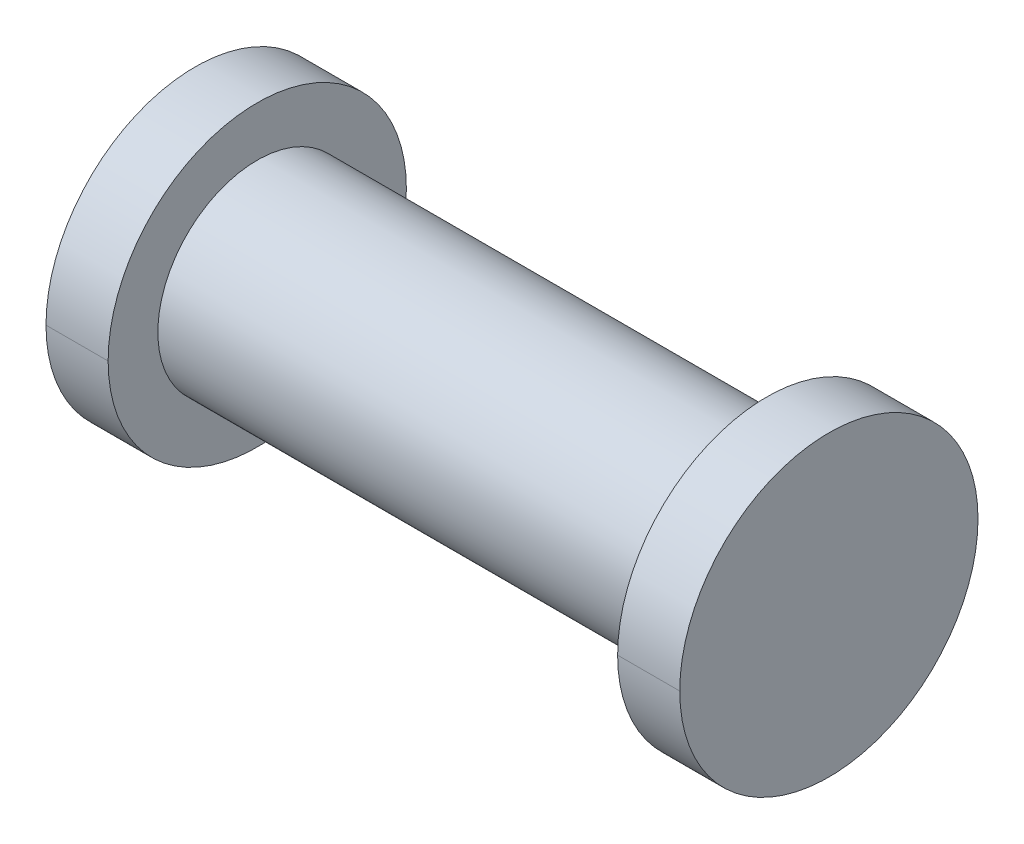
SolidWorks part; units mm, degrees
ref_plane "Plan de face" through (0, 0, 0) normal (0, 0, 1) x (1, 0, 0)
ref_plane "Plan de dessus" through (0, 0, 0) normal (0, 1, 0) x (1, 0, 0)
ref_plane "Plan de droite" through (0, 0, 0) normal (1, 0, 0) x (0, 0, -1)
sketch "Esquisse1" plane through (0, 0, 0) normal (0, 1, 0) x (1, 0, 0)
  line L0 (0, 0) -> (-23.3, 0) construction
  line L1 (0, 0) -> (0, 12)
  line L2 (0, 12) -> (-5, 12)
  line L3 (-5, 12) -> (-5, 8)
  line L4 (-5, 8) -> (-46, 8)
  line L5 (-46, 8) -> (-46, 12)
  line L6 (-46, 12) -> (-51, 12)
  line L7 (-51, 12) -> (-51, 0)
  line L8 (-51, 0) -> (0, 0)
  dimension "D1" = 5
  dimension "D2" = 5
  dimension "D3" = 41
  dimension "D4" = 12
  dimension "D5" = 12
  dimension "D6" = 8
revolve "Révolution1" add sketch "Esquisse1" angle 360 about L0
